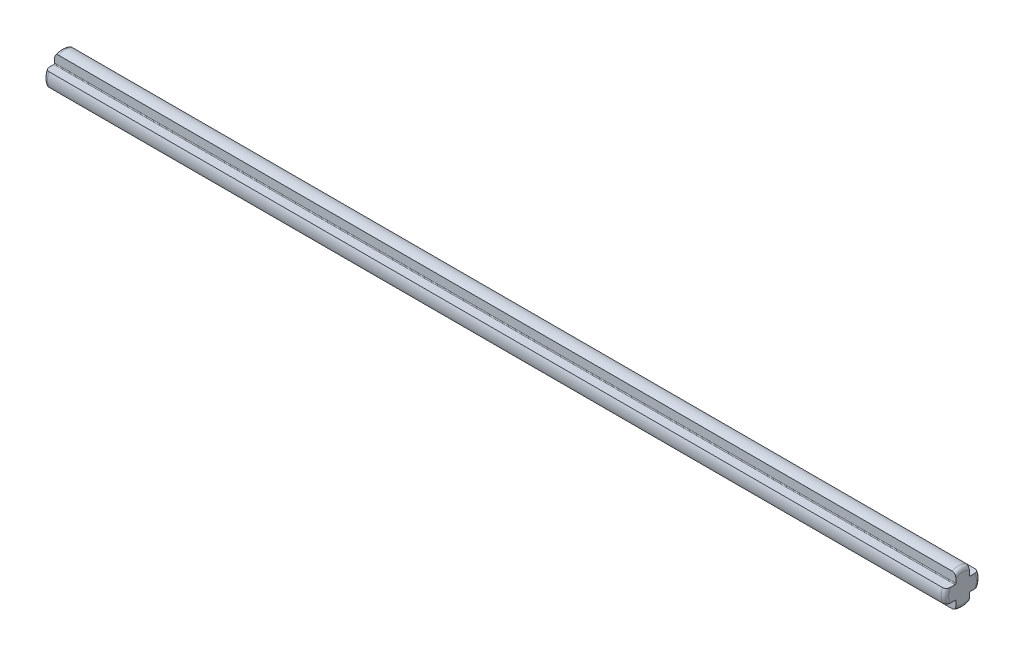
SolidWorks part; units mm, degrees
ref_plane "Alzado" through (0, 0, 0) normal (0, 0, 1) x (1, 0, 0)
ref_plane "Planta" through (0, 0, 0) normal (0, 1, 0) x (1, 0, 0)
ref_plane "Vista lateral" through (0, 0, 0) normal (1, 0, 0) x (0, 0, -1)
sketch "Croquis1" plane through (0, 0, 0) normal (1, 0, 0) x (0, 0, -1)
  line L0 (-3.7919, 0) -> (3.9132, 0) construction
  line L1 (-0.9, 2.1708) -> (-0.9, 1)
  line L2 (-2.1708, 0.9) -> (-1, 0.9)
  line L3 (2.1708, 0.9) -> (1, 0.9)
  line L4 (0.9, 2.1708) -> (0.9, 1)
  line L5 (0, 3.4809) -> (0, -0.8787) construction
  line L6 (0.9, -2.1708) -> (0.9, -1)
  line L7 (2.1708, -0.9) -> (1, -0.9)
  line L8 (-2.1708, -0.9) -> (-1, -0.9)
  line L9 (-0.9, -2.1708) -> (-0.9, -1)
  arc A0 (-2.1708, 0.9) -> (-2.1708, -0.9) centre (0, 0) ccw
  arc A1 (0.9, 2.1708) -> (-0.9, 2.1708) centre (0, 0) ccw
  arc A2 (-1, 0.9) -> (-0.9, 1) centre (-1, 1) ccw
  arc A3 (1, 0.9) -> (0.9, 1) centre (1, 1) cw
  arc A4 (2.1708, 0.9) -> (2.1708, -0.9) centre (0, 0) cw
  arc A5 (1, -0.9) -> (0.9, -1) centre (1, -1) ccw
  arc A6 (-1, -0.9) -> (-0.9, -1) centre (-1, -1) cw
  arc A7 (0.9, -2.1708) -> (-0.9, -2.1708) centre (0, 0) cw
  dimension "D1" = 2.35
  dimension "D4" = 0.1
  dimension "D2" = 1.8
  dimension "D3" = 1.8
extrude "Extruir1" add sketch "Croquis1" along normal mid plane 120
fillet "Redondeo1" radius 0.5 8 edges at (60, 2.35, 0) (60, 0, -2.35) (60, -2.35, 0) (60, 0, 2.35) (-60, -2.35, 0) (-60, 0, -2.35) (-60, 2.35, 0) (-60, 0, 2.35)
